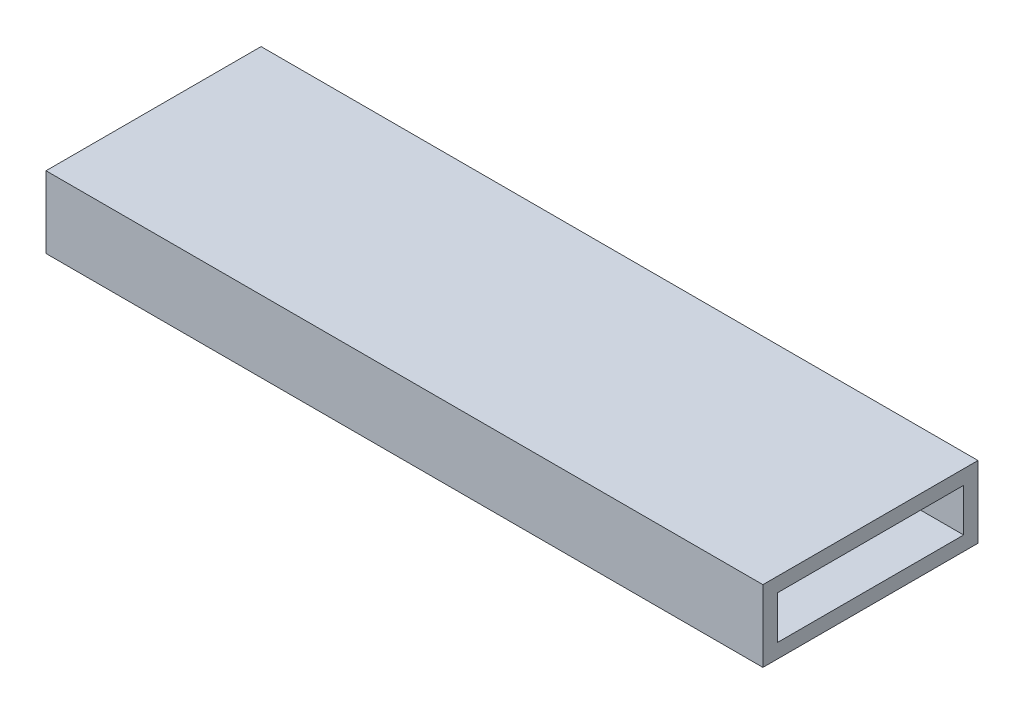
SolidWorks part; units mm, degrees
ref_plane "Front Plane" through (0, 0, 0) normal (0, 0, 1) x (1, 0, 0)
ref_plane "Top Plane" through (0, 0, 0) normal (0, 1, 0) x (1, 0, 0)
ref_plane "Right Plane" through (0, 0, 0) normal (1, 0, 0) x (0, 0, -1)
sketch "Sketch1" plane through (0, 0, 0) normal (1, 0, 0) x (0, 0, -1)
  line L1 (0, 0) -> (30, 0)
  line L2 (0, 0) -> (0, 10)
  line L3 (0, 10) -> (30, 10)
  line L4 (30, 0) -> (30, 10)
  dimension "D1" = 30
  dimension "D2" = 10
extrude "Boss-Extrude1" add sketch "Sketch1" along normal blind 100 contours L2 L1 L4 L3
sketch "Sketch2" plane through (0, 0, 0) normal (-1, 0, 0) x (0, 0, 1)
  line L0 (-30, 0) -> (-30, 10) construction
  line L1 (-28, 8) -> (-2, 8)
  line L2 (-28, 8) -> (-28, 2)
  line L3 (-28, 2) -> (-2, 2)
  line L4 (-2, 8) -> (-2, 2)
  line L5 (0, 0) -> (0, 10) construction
  line L6 (0, 0) -> (-30, 0) construction
  line L7 (0, 10) -> (-30, 10) construction
  dimension "D1" = 2
  dimension "D2" = 2
  dimension "D3" = 2
  dimension "D4" = 2
extrude "Cut-Extrude1" cut sketch "Sketch2" against normal through all contours L2 L1 L4 L3
